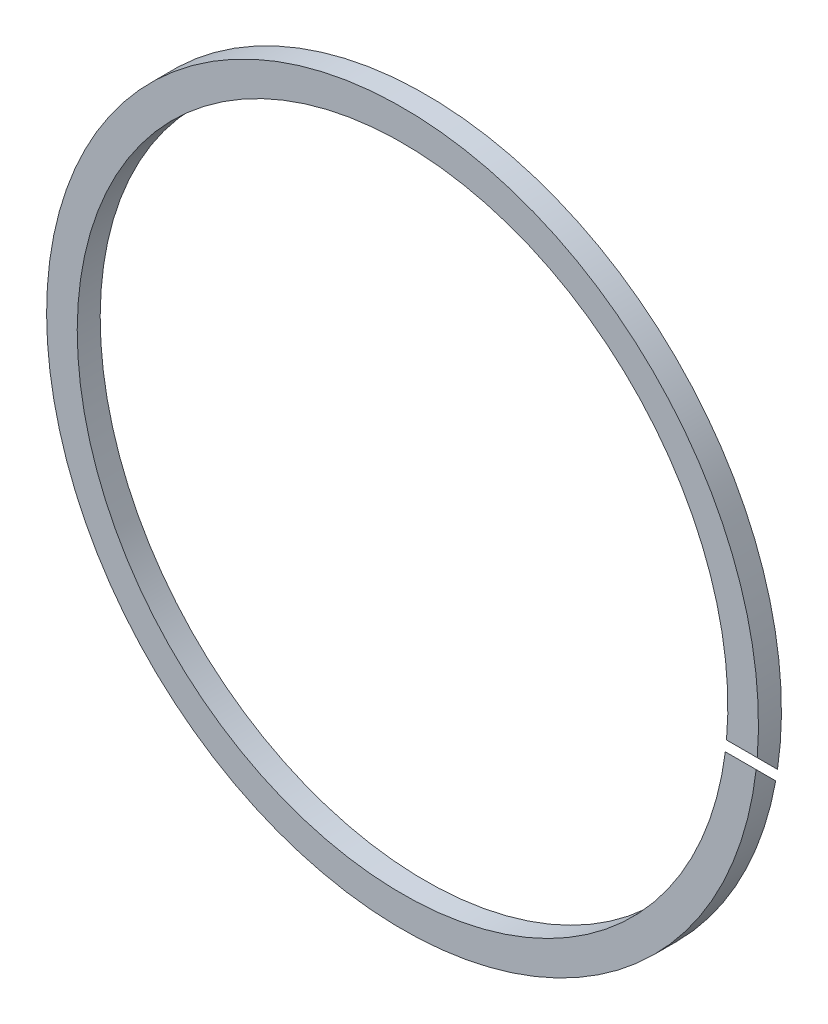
SolidWorks part; units mm, degrees
ref_plane "Front Plane" through (0, 0, 0) normal (0, 0, 1) x (1, 0, 0)
ref_plane "Top Plane" through (0, 0, 0) normal (0, 1, 0) x (1, 0, 0)
ref_plane "Right Plane" through (0, 0, 0) normal (1, 0, 0) x (0, 0, -1)
sketch "Sketch1" plane through (0, 0, 0) normal (0, 0, 1) x (1, 0, 0)
  circle A0 centre (0, 0) radius 46.5
  circle A1 centre (0, 0) radius 42.5
  dimension "D1" = 85
  dimension "D2" = 93
extrude "Extrude1" add sketch "Sketch1" along normal mid plane 3
sketch "Sketch3" plane through (0, 0, 0) normal (1, 0, 0) x (0, 0, -1)
  line L0 (-3.0961, -3) -> (3.0961, -9.1922)
  line L2 (1.5, -46.5) -> (1.5, 46.5) construction
  point P6 (0, -6.0961)
  dimension "D1" = 45
  dimension "D2" = 3
extrude "Cut-Extrude-Thin2" cut sketch "Sketch3" along normal up to next thin
